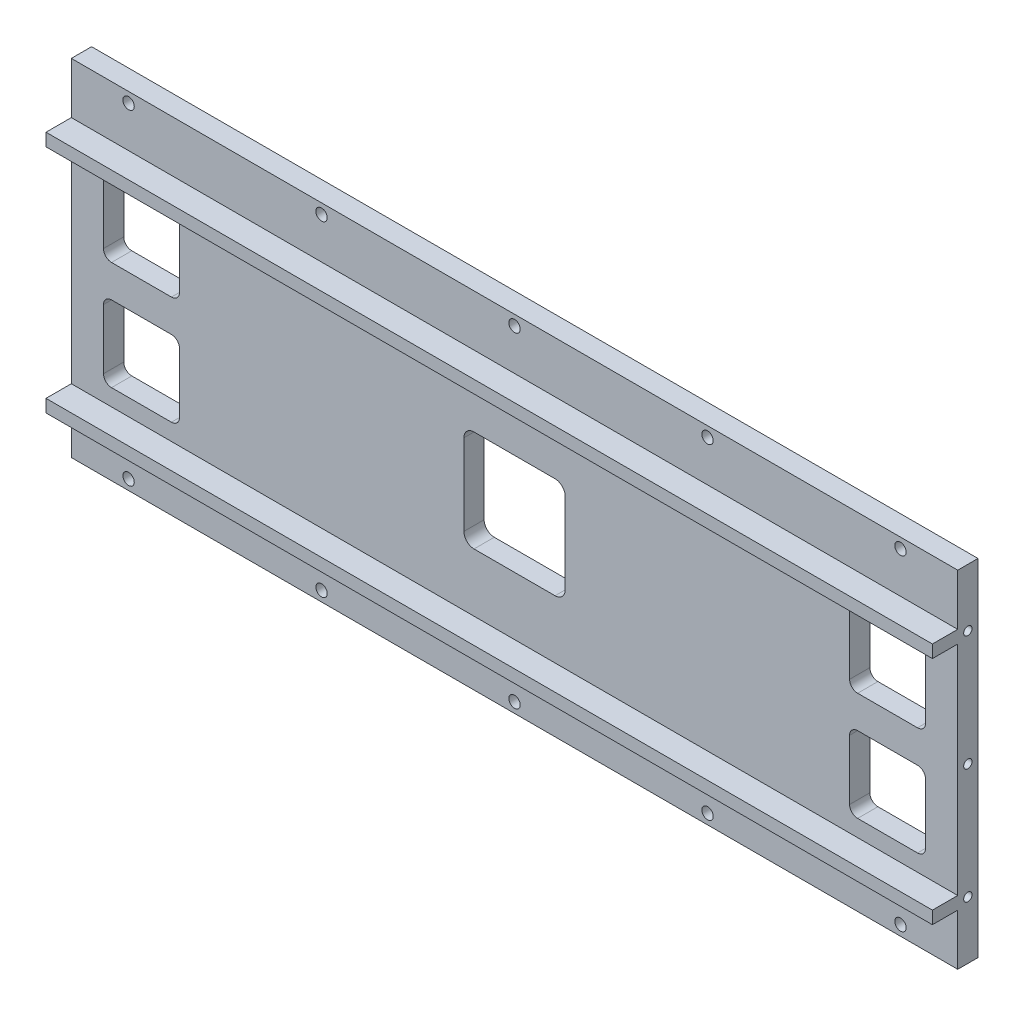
SolidWorks part; units mm, degrees
ref_plane "Front Plane" through (0, 0, 0) normal (0, 0, 1) x (1, 0, 0)
ref_plane "Top Plane" through (0, 0, 0) normal (0, 1, 0) x (1, 0, 0)
ref_plane "Right Plane" through (0, 0, 0) normal (1, 0, 0) x (0, 0, -1)
sketch "Sketch1" plane through (0, 0, 0) normal (0, 0, 1) x (1, 0, 0)
  line L1 (-175, 68.25) -> (175, 68.25)
  line L2 (-175, 68.25) -> (-175, -68.25)
  line L3 (-175, -68.25) -> (175, -68.25)
  line L4 (175, 68.25) -> (175, -68.25)
  point P4 (175, 0)
  point P6 (0, 68.25)
  dimension "D1" = 136.5
  dimension "D2" = 350
extrude "Boss-Extrude1" add sketch "Sketch1" along normal blind 8
sketch "Sketch2" plane through (0, 0, 8) normal (0, 0, 1) x (1, 0, 0)
  line L0 (-175, 68.25) -> (-175, -68.25) construction
  line L1 (-175, 48) -> (175, 48)
  line L2 (-175, 48) -> (-175, 43)
  line L3 (-175, 43) -> (175, 43)
  line L4 (175, 48) -> (175, 43)
  line L5 (175, -68.25) -> (175, 68.25) construction
  dimension "D1" = 5
  dimension "D2" = 43
extrude "Boss-Extrude2" add sketch "Sketch2" along normal blind 10
hole_wizard "M4 Clearance Hole1" positions "Sketch6" profile "Sketch7" hole size "M4" standard "ANSI Metric"
sketch "Sketch6" plane through (0, 0, 0) normal (0, 0, -1) x (-1, 0, 0)
  line L0 (-175, -68.25) -> (-175, 68.25) construction
  line L1 (9.9, 0) -> (-9.9, 0) construction
  point P0 (-152.4, 64.25)
  dimension "D1" = 22.6
  dimension "D2" = 64.25
sketch "Sketch7" plane through (152.4, 64.25, 0) normal (1, 0, 0) x (0, 1, 0)
  line L0 (0, 0) -> (0, 18)
  line L1 (0, 18) -> (2.25, 18)
  line L2 (2.25, 18) -> (2.25, 0)
  line L5 (2.25, 0) -> (0, 0)
  line L11 (0, -6.35) -> (0, 107.95) construction
  dimension "Thru Hole Dia." = 4.5
  dimension "Thru Hole Depth" = 18
pattern_linear "LPattern2" count 5 spacing 76.2 along (-1, 0, 0) of "M4 Clearance Hole1"
sketch "Sketch11" plane through (0, 0, 8) normal (0, 0, 1) x (1, 0, 0)
  line L0 (175, -68.25) -> (175, 43) construction
  line L1 (135.475, 36.4) -> (159.125, 36.4)
  line L2 (132.3, 33.225) -> (132.3, 9.575)
  line L3 (135.475, 6.4) -> (159.125, 6.4)
  line L4 (162.3, 33.225) -> (162.3, 9.575)
  line L5 (9.9, 0) -> (-9.9, 0) construction
  arc A0 (132.3, 9.575) -> (135.475, 6.4) centre (135.475, 9.575) ccw
  arc A1 (159.125, 6.4) -> (162.3, 9.575) centre (159.125, 9.575) ccw
  arc A2 (159.125, 36.4) -> (162.3, 33.225) centre (159.125, 33.225) cw
  arc A3 (135.475, 36.4) -> (132.3, 33.225) centre (135.475, 33.225) ccw
  point P10 (132.3, 6.4)
  point P13 (162.3, 6.4)
  point P16 (162.3, 36.4)
  dimension "D5" = 3.175
  dimension "D1" = 30
  dimension "D2" = 30
  dimension "D3" = 12.7
  dimension "D4" = 6.4
extrude "Cut-Extrude1" cut sketch "Sketch11" against normal up to next
mirror "Mirror4" about plane through (0, 0, 0) normal (0, 1, 0) of "Boss-Extrude2", "M4 Clearance Hole1", "LPattern2", "Cut-Extrude1"
hole_wizard "M4x0.7 Tapped Hole1" positions "Sketch8" profile "Sketch10" tap size "M4x0.7" standard "ANSI Metric"
sketch "Sketch8" plane through (175, 0, 0) normal (1, 0, 0) x (0, 0, -1)
  line L0 (0, -68.25) -> (0, 68.25) construction
  point P0 (-4, 0)
  point P7 (0, 0)
  dimension "D1" = 4
sketch "Sketch10" plane through (175, 0, 4) normal (0, 1, 0) x (0, 0, -1)
  line L0 (0, 0) -> (0, 14.9914)
  line L1 (0, 14.9914) -> (1.65, 14)
  line L2 (1.65, 14) -> (1.65, 0)
  line L5 (1.65, 0) -> (0, 0)
  line L10 (0, 14.9914) -> (-1.65, 14) construction
  line L11 (0, -6.35) -> (0, 107.95) construction
  dimension "Tap Drill Dia." = 3.3
  dimension "Tap Drill Depth" = 14
  dimension "Drill Angle" = 118
pattern_linear "LPattern3" count 2 spacing 45.5 along (0, 1, 0) count 2 spacing 45.5 along (0, -1, 0) of "M4x0.7 Tapped Hole1"
mirror "Mirror2" about plane through (0, 0, 0) normal (1, 0, 0) of "Mirror4", "Cut-Extrude1", "M4x0.7 Tapped Hole1", "LPattern3"
sketch "Sketch12" plane through (0, 0, 0) normal (0, 0, -1) x (-1, 0, 0)
  line L1 (16, -20) -> (-16, -20)
  line L2 (20, -16) -> (20, 16)
  line L3 (16, 20) -> (-16, 20)
  line L4 (-20, -16) -> (-20, 16)
  arc A1 (20, 16) -> (16, 20) centre (16, 16) ccw
  arc A2 (-16, 20) -> (-20, 16) centre (-16, 16) ccw
  arc A3 (-16, -20) -> (-20, -16) centre (-16, -16) cw
  arc A4 (16, -20) -> (20, -16) centre (16, -16) ccw
  point P4 (-20, 0)
  point P6 (0, 20)
  point P12 (20, 20)
  point P15 (-20, 20)
  point P18 (-20, -20)
  dimension "D3" = 4
  dimension "D1" = 40
  dimension "D2" = 40
extrude "Cut-Extrude2" cut sketch "Sketch12" against normal up to next
